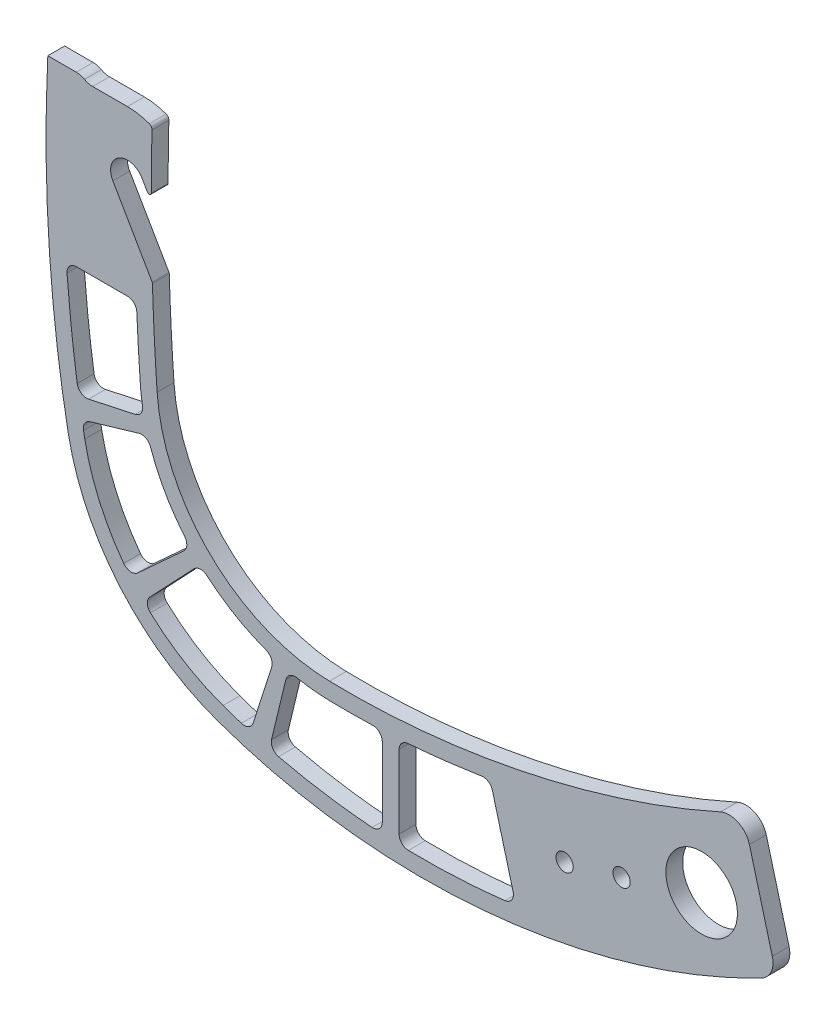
SolidWorks part; units mm, degrees
ref_plane "Plan de face" through (0, 0, 0) normal (0, 0, 1) x (1, 0, 0)
ref_plane "Plan de dessus" through (0, 0, 0) normal (0, 1, 0) x (1, 0, 0)
ref_plane "Plan de droite" through (0, 0, 0) normal (1, 0, 0) x (0, 0, -1)
sketch "Esquisse1" plane through (0, 0, 0) normal (0, 0, 1) x (1, 0, 0)
  line L0 (-0.7395, 9.26) -> (-0.7395, 0)
  line L1 (-0.7395, 0) -> (-8.7395, 0)
  line L2 (-11.212, -0.3463) -> (-15.725, -1.6357)
  line L3 (-0.7395, 13.66) -> (-19.6827, 8.2476)
  line L4 (89.2605, -120.251) -> (-60.7622, -160.4495) construction
  line L5 (89.2605, -120.251) -> (-87.485, -120.251) construction
  line L6 (-86.1521, -200) -> (170.4283, -200) construction
  line L7 (89.2605, -183.0726) -> (89.2605, -200) construction
  line L8 (-0.7395, 13.66) -> (38.0779, 22.1236)
  line L9 (-0.7395, 13.66) -> (-0.7395, 74.26) construction
  line L10 (89.2605, -200) -> (89.2605, -216.9274) construction
  line L11 (101.2572, -177.7054) -> (109.2605, -207.5742)
  arc A2 (-8.7395, 0) -> (-11.212, -0.3463) centre (-8.7395, -9) ccw
  arc A8 (-0.7395, 9.26) -> (38.0779, 22.1236) centre (-0.7395, 74.26) ccw
  ellipse E0 centre (-14.2395, -121.4237) end of major axis (-14.2395, -1.4237) minor radius 25 (-15.725, -1.6357) -> (-34.1467, -194.014) ccw
  ellipse E1 centre (-14.2395, -121.4237) end of major axis (-14.2395, 9.0229) minor radius 50 (-19.6827, 8.2476) -> (-52.4262, -205.6311) ccw
  ellipse E3 centre (45.7938, -131.8979) end of major axis (-80.047, -165.6168) minor radius 94.5 (-52.4262, -205.6311) -> (109.2605, -207.5742) ccw
  ellipse E4 centre (45.7938, -131.8979) end of major axis (-70.1173, -162.9562) minor radius 62.5 (-34.1467, -194.014) -> (101.2572, -177.7054) ccw
  point P15 (-10, 0)
  dimension "D3" = 240
  dimension "D9" = 65
  dimension "D10" = 60.6
  dimension "D13" = 13.5
  dimension "D14" = 15
  dimension "D15" = 125
  dimension "D16" = 9
  dimension "D19" = 200
  dimension "D18" = 260.56
  dimension "D4" = 90
  dimension "D5" = 32
  dimension "D6" = 13.66
  dimension "D7" = 8
  dimension "D8" = 102.3
  dimension "D11" = 50
  dimension "D12" = 25
  dimension "D17" = 240
  dimension "D20" = 45
  dimension "D21" = 20
  dimension "D22" = 30.9225
extrude "Boss.-Extru.1" add sketch "Esquisse1" along normal blind 4
fillet "Congé1" radius 3.2 1 edges at (-0.7395, 9.26, 2)
fillet "Congé2" radius 0.8 1 edges at (38.0779, 22.1236, 2)
sketch "Esquisse6" plane through (0, 0, 4) normal (0, 0, 1) x (1, 0, 0)
  line L0 (34.166, 21.2706) -> (-0.7395, 13.66) construction
  circle A0 centre (13.8526, 13.8888) radius 1.5
  arc A1 (34.7735, 19.8189) -> (34.166, 21.2706) centre (34.3364, 20.489) ccw construction
  dimension "D1" = 3
  dimension "D3" = 21.5209
  dimension "D2" = 2.8851
extrude "Enlèv. mat.-Extru.2" cut sketch "Esquisse6" against normal blind 4
fillet "Congé4" radius 42 1 edges at (-34.1467, -194.014, 2)
fillet "Congé5" radius 55 1 edges at (-52.4262, -205.6311, 2)
fillet "Congé6" radius 5 2 edges at (109.2605, -207.5742, 2) (101.2572, -177.7054, 2)
sketch "Esquisse7" plane through (0, 0, 4) normal (0, 0, 1) x (1, 0, 0)
  line L0 (-145.1435, -104.5541) -> (34.7735, -104.5541)
  line L1 (34.7735, 19.8189) -> (34.7735, -228.9271) construction
  arc A0 (34.7735, 19.8189) -> (34.166, 21.2706) centre (34.3364, 20.489) ccw construction
  ellipse E0 centre (45.7938, -131.8979) end of major axis (-80.047, -165.6168) minor radius 94.5 (-23.5509, -221.1552) -> (105.7042, -209.472) ccw construction
extrude "Enlèv. mat.-Extru.3" cut sketch "Esquisse7" against normal through all and the other way through all
hole_wizard "Diamètre du perçage Ø17.0 (17)1" positions "Esquisse9" profile "Esquisse8" hole size "Ø17.0" standard "ISO"
sketch "Esquisse9" plane through (0, 0, 4) normal (0, 0, 1) x (1, 0, 0)
  line L0 (87.3712, -183.8379) -> (95.5396, -214.3227) construction
  line L2 (108.2328, -203.7388) -> (102.802, -183.4706) construction
  ellipse E0 centre (45.7938, -131.8979) end of major axis (161.7049, -100.8396) minor radius 62.5 (3.0581, -199.7417) -> (95.9166, -180.2069) ccw construction
  ellipse E1 centre (45.7938, -131.8979) end of major axis (-80.047, -165.6168) minor radius 94.5 (-23.5509, -221.1552) -> (105.7042, -209.472) ccw construction
  point P0 (91.4554, -199.0803)
  dimension "D1" = 15
sketch "Esquisse8" plane through (91.4554, -199.0803, 4) normal (1, 0, 0) x (0, -1, 0)
  line L0 (0, 0) -> (0, 65.1073)
  line L1 (0, 65.1073) -> (8.5, 60)
  line L2 (8.5, 60) -> (8.5, 0)
  line L5 (8.5, 0) -> (0, 0)
  line L10 (0, 65.1073) -> (-8.5, 60) construction
  line L11 (0, -6.35) -> (0, 107.95) construction
  dimension "Diamètre du perçage" = 17
  dimension "Profondeur du perçage" = 60
  dimension "Angle de pointe" = 118
hole_wizard "Diamètre du perçage Ø4.1 (4.1)1" positions "Esquisse11" profile "Esquisse10" hole size "Ø4.1" standard "ISO"
sketch "Esquisse11" plane through (0, 0, 4) normal (0, 0, 1) x (1, 0, 0)
  line L0 (108.2328, -203.7388) -> (102.802, -183.4706) construction
  spline S0 degree 3 poles (1636.1325, 896.3344) (-319.9586, 41.4316) (-178.4378, -234.3983) (35.9687, -213.4494) (44.5098, -212.1289) (61.5079, -208.553) (69.9644, -206.2976) (283.0026, -137.1342) (368.5788, 191.5259) (-1860.2024, 28.4393) knots -5.855707 -5.855707 -5.855707 -5.855707 0.25 0.25 0.5 0.5 0.75 0.75 6.945634 6.945634 6.945634 6.945634 only from (2.6979, -215.2375) to (102.2895, -194.3362)
  spline S1 degree 3 poles (2.6979, -215.2375) (10.7759, -215.4253) (19.1014, -215.0974) (35.9687, -213.4494) (44.5098, -212.1289) (61.5079, -208.553) (69.9644, -206.2976) (86.4902, -200.9324) (94.559, -197.823) (102.2895, -194.3362) knots 0 0 0 0 0.25 0.25 0.5 0.5 0.75 0.75 1 1 1 1 construction
  point P0 (58.9195, -209.0206)
  point P1 (72.4467, -205.4127)
  dimension "D2" = 14
  dimension "D3" = 35
  dimension "D1" = 15.5
sketch "Esquisse10" plane through (58.9195, -209.0206, 4) normal (1, 0, 0) x (0, -1, 0)
  line L0 (0, 0) -> (0, 61.2318)
  line L1 (0, 61.2318) -> (2.05, 60)
  line L2 (2.05, 60) -> (2.05, 0)
  line L5 (2.05, 0) -> (0, 0)
  line L10 (0, 61.2318) -> (-2.05, 60) construction
  line L11 (0, -6.35) -> (0, 107.95) construction
  dimension "Diamètre du perçage" = 4.1
  dimension "Profondeur du perçage" = 60
  dimension "Angle de pointe" = 118
sketch "Esquisse12" plane through (0, 0, 4) normal (0, 0, 1) x (1, 0, 0)
  line L0 (-38.9912, -104.5541) -> (-63.8196, -104.5541) construction
  line L1 (-38.9912, -104.5541) -> (-55.8196, -104.5541)
  line L2 (-41.4413, -118.5541) -> (-39.2387, -122.3691)
  line L3 (-48.3695, -122.5541) -> (-38.9752, -138.8255)
  line L4 (-51.4054, -104.5541) -> (-51.4054, -135.2034) construction
  line L5 (-44.9054, -105.5541) -> (-55.8196, -105.5541)
  line L6 (-55.8196, -105.5541) -> (-55.8196, -104.5541)
  arc A0 (-41.4413, -118.5541) -> (-48.3695, -122.5541) centre (-44.9054, -120.5541) ccw
  arc A1 (-39.0517, -106.7435) -> (-44.9054, -105.5541) centre (-44.9054, -120.5541) ccw
  ellipse E0 centre (-14.2395, -121.4237) end of major axis (-14.2395, -241.4237) minor radius 25 (-38.9912, -104.5541) -> (-37.8565, -160.7831) ccw construction
  ellipse E1 centre (-14.2395, -121.4237) end of major axis (-14.2395, -241.4237) minor radius 25 (-38.9912, -104.5541) -> (-39.0517, -106.7435) ccw
  ellipse E2 centre (-14.2395, -121.4237) end of major axis (-14.2395, -241.4237) minor radius 25 (-39.2387, -122.3691) -> (-38.9752, -138.8255) ccw
  dimension "D1" = 8
  dimension "D3" = 6.5
  dimension "D5" = 30
  dimension "D2" = 16
  dimension "D4" = 30
  dimension "D6" = 8
extrude "Enlèv. mat.-Extru.4" cut sketch "Esquisse12" against normal through all
fillet "Congé7" radius 0.5 2 edges
fillet "Congé8" radius 1 1 edges
fillet "Congé9" radius 4 1 edges at (-55.8196, -105.5541, 2)
fillet "Congé10" radius 4 1 edges at (-55.8196, -104.5541, 2)
sketch "Esquisse13" plane through (0, 0, 4) normal (0, 0, 1) x (1, 0, 0)
  line L0 (-63.6989, -140.5541) -> (-38.9198, -140.5541) construction
  line L1 (44.1218, -196.2953) -> (52.3508, -227.0064) construction
  line L2 (108.2328, -203.7388) -> (102.802, -183.4706) construction
  line L3 (-57.0469, -104.5541) -> (-63.8196, -104.5541) construction
  line L4 (19.6167, -199.3718) -> (19.6167, -229.1135) construction
  line L5 (-59.5619, -176.5138) -> (-36.2496, -169.6367) construction
  line L6 (-51.1092, -144.5491) -> (-48.8851, -169.197) construction
  line L7 (-48.8851, -169.197) -> (-47.9057, -173.0753) construction
  line L8 (-47.9057, -173.0753) -> (-37.0929, -195.3362) construction
  line L9 (-37.0929, -195.3362) -> (-34.3564, -198.2536) construction
  line L10 (-34.3564, -198.2536) -> (-12.8081, -210.4248) construction
  line L11 (-12.8081, -210.4248) -> (-8.9896, -211.6161) construction
  line L12 (-8.9896, -211.6161) -> (15.6168, -214.2611) construction
  line L13 (15.6168, -214.2611) -> (19.6167, -214.2427) construction
  line L14 (19.6167, -214.2427) -> (44.2876, -212.2896) construction
  line L15 (44.2876, -212.2896) -> (48.2363, -211.6509) construction
  line L16 (-51.3093, -140.5541) -> (-51.1092, -144.5491) construction
  line L17 (-59.4379, -144.5491) -> (-42.7742, -144.5491)
  line L18 (-40.9266, -167.476) -> (-56.4639, -170.836)
  line L19 (-63.4475, -144.5491) -> (-38.7709, -144.5491) construction
  line L20 (-60.3794, -171.6827) -> (-37.3908, -166.7113) construction
  line L21 (-55.7016, -175.375) -> (-40.0862, -170.7685)
  line L22 (-47.2157, -204.5867) -> (-26.9701, -186.0857) construction
  line L23 (-29.9229, -188.784) -> (-44.2595, -201.8853)
  line L24 (-43.853, -208.2723) -> (-24.8597, -188.235) construction
  line L25 (-16.8584, -223.092) -> (-8.7577, -197.7577) construction
  line L26 (-12.1424, -224.6555) -> (-5.8367, -198.5766) construction
  line L27 (15.6168, -228.9277) -> (15.6168, -199.5945) construction
  line L28 (-41.1001, -205.3681) -> (-27.6115, -191.138)
  line L29 (48.3892, -227.5971) -> (40.186, -196.9821) construction
  line L30 (-9.9759, -201.5676) -> (-15.715, -219.516)
  line L31 (-11.2022, -220.7672) -> (-6.7768, -202.4646)
  line L32 (15.6168, -203.5986) -> (15.6168, -224.9205)
  line L33 (19.6167, -225.1112) -> (19.6167, -203.3803)
  line L34 (41.2261, -200.8641) -> (47.3456, -223.7023)
  line L35 (2.8475, -203.7377) -> (2.9652, -203.7406)
  arc A0 (-37.8565, -160.7831) -> (3.0581, -199.7417) centre (4.0341, -157.753) ccw construction
  arc A1 (-58.9636, -179.7467) -> (-23.5509, -221.1552) centre (-4.9461, -169.3975) ccw construction
  arc A2 (-37.8565, -160.7831) -> (3.0581, -199.7417) centre (4.0341, -157.753) ccw construction
  arc A3 (-58.9636, -179.7467) -> (-23.5509, -221.1552) centre (-4.9461, -169.3975) ccw construction
  arc A4 (-41.8461, -161.0717) -> (-40.9266, -167.476) centre (4.0341, -157.753) ccw
  arc A5 (-40.0862, -170.7685) -> (-29.9229, -188.784) centre (4.0341, -157.753) ccw
  arc A6 (-27.6115, -191.138) -> (-9.9759, -201.5676) centre (4.0341, -157.753) ccw
  arc A7 (-41.8461, -161.0717) -> (2.9652, -203.7406) centre (4.0341, -157.753) ccw construction
  arc A8 (-6.7768, -202.4646) -> (2.8475, -203.7377) centre (4.0341, -157.753) ccw
  arc A9 (-41.1001, -205.3681) -> (-22.1978, -217.391) centre (-4.9461, -169.3975) ccw
  arc A10 (-55.0351, -178.994) -> (-44.2595, -201.8853) centre (-4.9461, -169.3975) ccw
  arc A11 (-55.0351, -178.994) -> (-22.1978, -217.391) centre (-4.9461, -169.3975) ccw construction
  arc A13 (-55.0351, -178.994) -> (-22.1978, -217.391) centre (-4.9461, -169.3975) ccw construction
  ellipse E0 centre (-14.2395, -121.4237) end of major axis (-14.2395, 9.0229) minor radius 50 (-63.8196, -104.5541) -> (-58.9636, -179.7467) ccw construction
  ellipse E1 centre (-14.2395, -121.4237) end of major axis (-14.2395, -241.4237) minor radius 25 (-38.9714, -138.9512) -> (-37.8565, -160.7831) ccw construction
  ellipse E2 centre (45.7938, -131.8979) end of major axis (-80.047, -165.6168) minor radius 94.5 (-23.5509, -221.1552) -> (105.7042, -209.472) ccw construction
  ellipse E3 centre (45.7938, -131.8979) end of major axis (161.7049, -100.8396) minor radius 62.5 (3.0581, -199.7417) -> (95.9166, -180.2069) ccw construction
  ellipse E4 centre (-14.2395, -121.4237) end of major axis (-14.2395, -241.4237) minor radius 25 (-38.9714, -138.9512) -> (-37.8565, -160.7831) ccw construction
  ellipse E5 centre (45.7938, -131.8979) end of major axis (161.7049, -100.8396) minor radius 62.5 (3.0581, -199.7417) -> (95.9166, -180.2069) ccw construction
  ellipse E6 centre (45.7938, -131.8979) end of major axis (-80.047, -165.6168) minor radius 94.5 (-23.5509, -221.1552) -> (105.7042, -209.472) ccw construction
  ellipse E7 centre (-14.2395, -121.4237) end of major axis (-14.2395, 9.0229) minor radius 50 (-63.8196, -104.5541) -> (-58.9636, -179.7467) ccw construction
  spline S0 degree 1 poles (-59.8246, -104.7538) (-55.0351, -178.994) knots 0 0 1 1 construction
  spline S1 degree 3 poles (-59.8246, -104.7538) (-59.9831, -107.9234) (-60.2083, -114.2568) (-60.299, -127.0167) (-59.845, -139.7385) (-58.8552, -152.2204) (-57.8494, -161.4083) (-56.798, -168.871) (-55.8301, -174.7129) (-55.3092, -177.5634) (-55.0351, -178.994) knots 1.441111 1.441111 1.441111 1.441111 1.515262 1.589413 1.737715 1.811867 1.886018 1.960169 1.997244 2.03432 2.03432 2.03432 2.03432 only from (-59.4379, -144.5491) to (-56.4639, -170.836)
  spline S2 degree 1 poles (-42.9695, -139.0742) (-41.8461, -161.0717) knots 0 0 1 1 construction
  spline S3 degree 3 poles (-42.9695, -139.0742) (-42.9122, -140.9366) (-42.7786, -144.6724) (-42.5246, -150.2046) (-42.2158, -155.6896) (-41.9762, -159.2722) (-41.8461, -161.0717) knots -1.424209 -1.424209 -1.424209 -1.424209 -1.377311 -1.330412 -1.283514 -1.236615 -1.236615 -1.236615 -1.236615 only from (-42.7742, -144.5491) to (-41.8461, -161.0717)
  spline S4 degree 1 poles (2.9652, -203.7406) (97.5612, -183.8532) knots 0 0 1 1 construction
  spline S5 degree 3 poles (2.9652, -203.7406) (4.8777, -203.7851) (8.6812, -203.8123) (16.4711, -203.6275) (26.3829, -202.9461) (38.4802, -201.4191) (50.6493, -199.1989) (62.7711, -196.3089) (74.7252, -192.7776) (84.4423, -189.3319) (92.0224, -186.2887) (95.7187, -184.6842) (97.5612, -183.8532) knots -2.083257 -2.083257 -2.083257 -2.083257 -2.032233 -1.98121 -1.879162 -1.777114 -1.675067 -1.573019 -1.470972 -1.368924 -1.3179 -1.266876 -1.266876 -1.266876 -1.266876 only from (2.9652, -203.7406) to (15.6168, -203.5986)
  spline S6 degree 1 poles (2.9652, -203.7406) (97.5612, -183.8532) knots 0 0 1 1 construction
  spline S7 degree 3 poles (2.9652, -203.7406) (4.8777, -203.7851) (8.6812, -203.8123) (16.4711, -203.6275) (26.3829, -202.9461) (38.4802, -201.4191) (50.6493, -199.1989) (62.7711, -196.3089) (74.7252, -192.7776) (84.4423, -189.3319) (92.0224, -186.2887) (95.7187, -184.6842) (97.5612, -183.8532) knots -2.083257 -2.083257 -2.083257 -2.083257 -2.032233 -1.98121 -1.879162 -1.777114 -1.675067 -1.573019 -1.470972 -1.368924 -1.3179 -1.266876 -1.266876 -1.266876 -1.266876 only from (19.6167, -203.3803) to (41.2261, -200.8641)
  spline S8 degree 1 poles (-22.1978, -217.391) (103.8634, -205.9207) knots 0 0 1 1 construction
  spline S9 degree 3 poles (-22.1978, -217.391) (-21.0423, -217.8064) (-18.7275, -218.5982) (-13.9778, -220.0639) (-7.8758, -221.653) (-0.3066, -223.1665) (10.0637, -224.6474) (23.4635, -225.4757) (39.9516, -224.8075) (56.5499, -222.4852) (72.9607, -218.5472) (86.2274, -213.981) (96.4658, -209.6007) (101.4141, -207.1903) (103.8634, -205.9207) knots 0.807289 0.807289 0.807289 0.807289 0.840345 0.873402 0.939516 1.005629 1.071743 1.203969 1.336196 1.468423 1.60065 1.732877 1.798991 1.865104 1.865104 1.865104 1.865104 only from (19.6167, -225.1112) to (47.3456, -223.7023)
  spline S10 degree 1 poles (-22.1978, -217.391) (103.8634, -205.9207) knots 0 0 1 1 construction
  spline S11 degree 3 poles (-22.1978, -217.391) (-21.0423, -217.8064) (-18.7275, -218.5982) (-13.9778, -220.0639) (-7.8758, -221.653) (-0.3066, -223.1665) (10.0637, -224.6474) (23.4635, -225.4757) (39.9516, -224.8075) (56.5499, -222.4852) (72.9607, -218.5472) (86.2274, -213.981) (96.4658, -209.6007) (101.4141, -207.1903) (103.8634, -205.9207) knots 0.807289 0.807289 0.807289 0.807289 0.840345 0.873402 0.939516 1.005629 1.071743 1.203969 1.336196 1.468423 1.60065 1.732877 1.798991 1.865104 1.865104 1.865104 1.865104 only from (-11.2022, -220.7672) to (15.6168, -224.9205)
  spline S12 degree 1 poles (-22.1978, -217.391) (103.8634, -205.9207) knots 0 0 1 1 construction
  spline S13 degree 3 poles (-22.1978, -217.391) (-21.0423, -217.8064) (-18.7275, -218.5982) (-13.9778, -220.0639) (-7.8758, -221.653) (-0.3066, -223.1665) (10.0637, -224.6474) (23.4635, -225.4757) (39.9516, -224.8075) (56.5499, -222.4852) (72.9607, -218.5472) (86.2274, -213.981) (96.4658, -209.6007) (101.4141, -207.1903) (103.8634, -205.9207) knots 0.807289 0.807289 0.807289 0.807289 0.840345 0.873402 0.939516 1.005629 1.071743 1.203969 1.336196 1.468423 1.60065 1.732877 1.798991 1.865104 1.865104 1.865104 1.865104 only from (-22.1978, -217.391) to (-15.715, -219.516)
  spline S14 degree 1 poles (-59.8246, -104.7538) (-55.0351, -178.994) knots 0 0 1 1 construction
  spline S15 degree 3 poles (-59.8246, -104.7538) (-59.9831, -107.9234) (-60.2083, -114.2568) (-60.299, -127.0167) (-59.845, -139.7385) (-58.8552, -152.2204) (-57.8494, -161.4083) (-56.798, -168.871) (-55.8301, -174.7129) (-55.3092, -177.5634) (-55.0351, -178.994) knots 1.441111 1.441111 1.441111 1.441111 1.515262 1.589413 1.737715 1.811867 1.886018 1.960169 1.997244 2.03432 2.03432 2.03432 2.03432 only from (-55.7016, -175.375) to (-55.0351, -178.994)
  point P82 (2.1732, -159.6978)
  point P94 (-41.375, -167.0667)
  point P95 (2.4717, -163.3972)
  point P96 (0.6864, -208.3223)
  point P98 (-41.6989, -163.0501)
  point P99 (-55.2127, -178.0547)
  point P100 (-5.1245, -168.4542)
  point P101 (22.4378, -222.5681)
  dimension "D3" = 4
  dimension "D5" = 4
  dimension "D1" = 60
  dimension "D2" = 36
  dimension "D4" = 4
  dimension "D6" = 4
  dimension "D7" = 4
  dimension "D8" = 4
  dimension "D9" = 4
  dimension "D10" = 4
  dimension "D11" = 4
extrude "Enlèv. mat.-Extru.5" cut sketch "Esquisse13" against normal through all
fillet "Congé11" radius 2.25 20 edges at (15.6168, -224.9205, 2) (19.6167, -225.1112, 2) (47.3456, -223.7023, 2) (41.2261, -200.8641, 2) (19.6167, -203.3803, 2) (-11.2022, -220.7672, 2) (-59.4379, -144.5491, 2) (-42.7742, -144.5491, 2) (-40.0862, -170.7685, 2) (-55.7016, -175.375, 2) (-41.1001, -205.3681, 2) (-27.6115, -191.138, 2) (-15.715, -219.516, 2) (-9.9759, -201.5676, 2) (-44.2595, -201.8853, 2) (-29.9229, -188.784, 2) (-40.9266, -167.476, 2) (-56.4639, -170.836, 2) (15.6168, -203.5986, 2) (-6.7768, -202.4646, 2)
